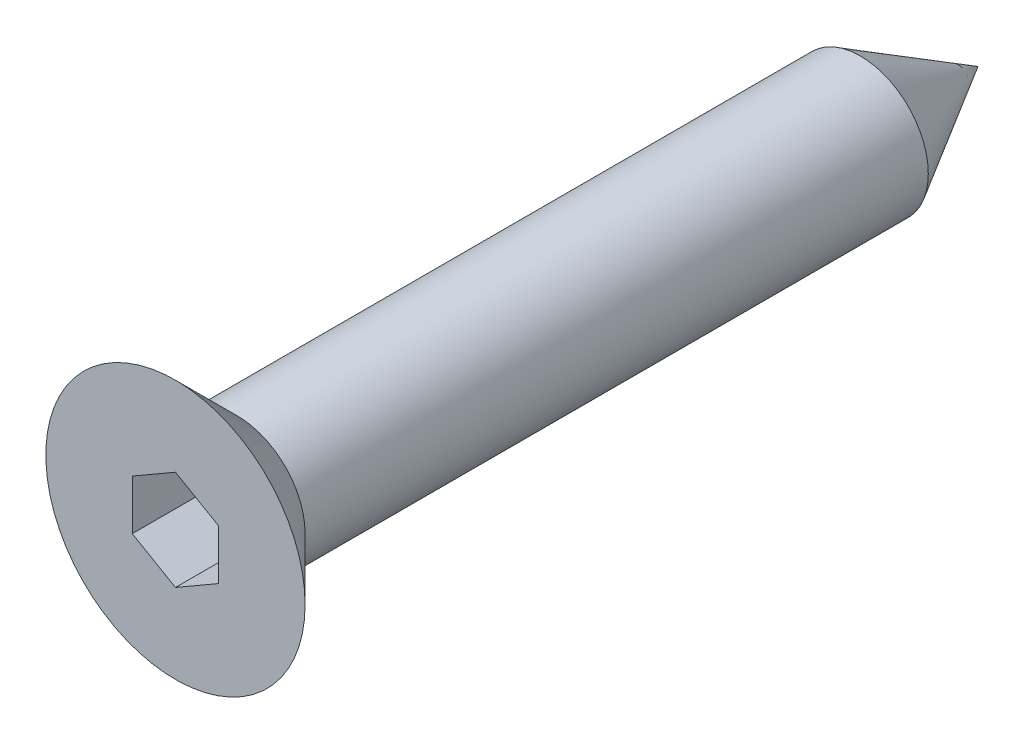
SolidWorks part; units mm, degrees
ref_plane "Plan de face" through (0, 0, 0) normal (0, 0, 1) x (1, 0, 0)
ref_plane "Plan de dessus" through (0, 0, 0) normal (0, 1, 0) x (1, 0, 0)
ref_plane "Plan de droite" through (0, 0, 0) normal (1, 0, 0) x (0, 0, -1)
sketch "Esquisse1" plane through (0, 0, 0) normal (1, 0, 0) x (0, 0, -1)
  line L0 (-1.6035, 0) -> (7.1529, 0) construction
  line L1 (0, 5.0438) -> (0, -4.594) construction
  line L2 (0, 2.1) -> (1, 1.1)
  line L3 (1, 1.1) -> (1, 0)
  line L5 (0, 2.1) -> (8.0645, -5.9645) construction
  line L6 (-1.0465, 1.1) -> (4.1553, 1.1) construction
  line L7 (1, 0) -> (0, 0)
  line L9 (0, 2.1) -> (0, 0)
  dimension "D1" = 45
revolve "Révolution2" add sketch "Esquisse1" angle 360 about L0
sketch "Esquisse3" plane through (0, 0, 0) normal (0, 0, 1) x (1, 0, 0)
  circle A0 centre (0, 0) radius 1.1
extrude "Extrusion1" add sketch "Esquisse3" against normal blind 13
sketch "Esquisse2" plane through (0, 0, 0) normal (0, 0, 1) x (1, 0, 0)
  line L1 (0, 0.8083) -> (-0.7, 0.4041)
  line L2 (-0.7, 0.4041) -> (-0.7, -0.4041)
  line L3 (-0.7, -0.4041) -> (0, -0.8083)
  line L4 (0, -0.8083) -> (0.7, -0.4041)
  line L5 (0.7, -0.4041) -> (0.7, 0.4041)
  line L6 (0.7, 0.4041) -> (0, 0.8083)
  circle A0 centre (0, 0) radius 1.8 construction
  circle A1 centre (0, 0) radius 0.7 construction
extrude "Enlèv. mat.-Extru.2" cut sketch "Esquisse2" against normal blind 1.5
chamfer "Chanfrein1" distance 1.1 angle 60 1 edges at (1.1, 0, -13)
